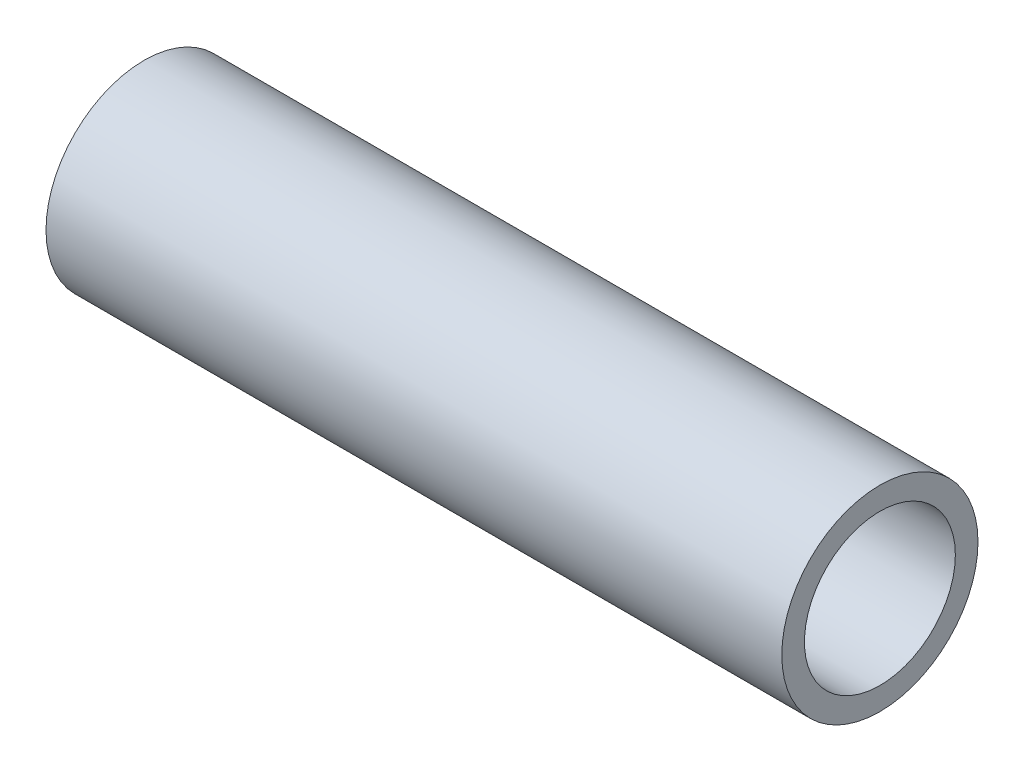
SolidWorks part; units mm, degrees
ref_plane "Front" through (0, 0, 0) normal (0, 0, 1) x (1, 0, 0)
ref_plane "Top" through (0, 0, 0) normal (0, 1, 0) x (1, 0, 0)
ref_plane "Right" through (0, 0, 0) normal (1, 0, 0) x (0, 0, -1)
sketch "Sketch1" plane through (0, 0, 0) normal (0, 0, 1) x (1, 0, 0)
  line L0 (0, 0) -> (123.825, 0)
  line L1 (9.9848, 0) -> (-9.9848, 0) construction
  dimension "D1" = 123.825
other "Structural Member1"
ref_plane "Plane1" through (0, 0, 0) normal (1, 0, 0) x (0, 0, -1)
sketch "Sketch11" plane through (0, 0, 0) normal (1, 0, 0) x (0, 0, -1)
  circle A0 centre (0, 0) radius 12.7
  circle A1 centre (0, 0) radius 16.51
  point P3 (0, 0)
  dimension "D1" = 33.02
  dimension "D2" = 25.4
